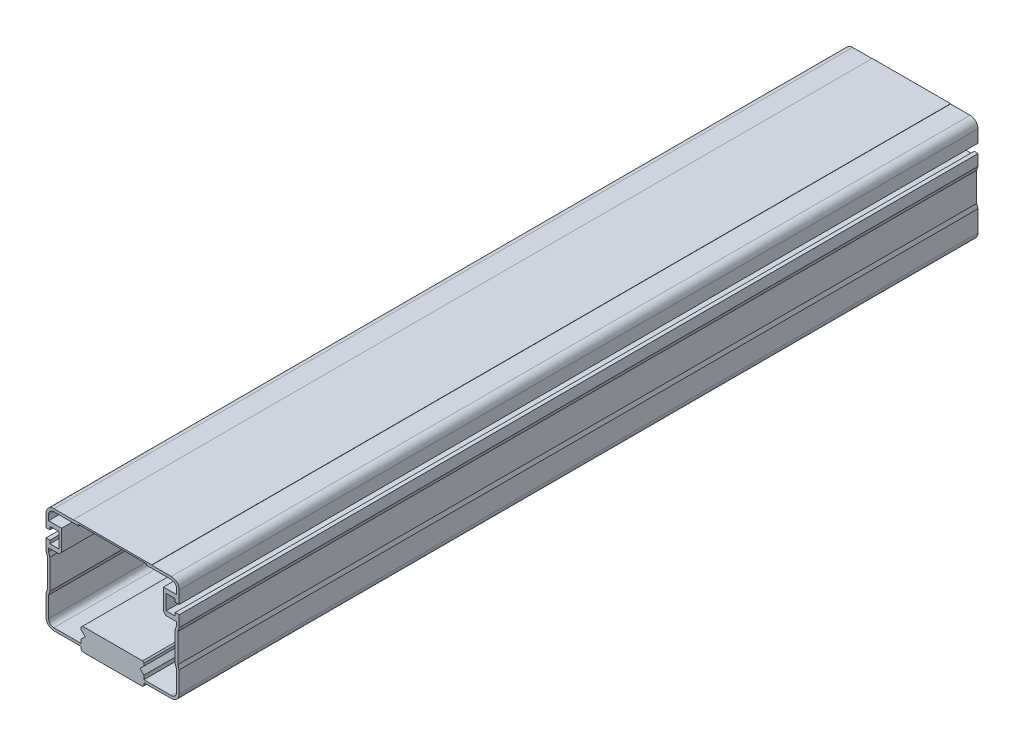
SolidWorks part; units mm, degrees
ref_plane "前视基准面" through (0, 0, 0) normal (0, 0, 1) x (1, 0, 0)
ref_plane "上视基准面" through (0, 0, 0) normal (0, 1, 0) x (1, 0, 0)
ref_plane "右视基准面" through (0, 0, 0) normal (1, 0, 0) x (0, 0, -1)
sketch "草图1" plane through (0, 0, 0) normal (0, 0, 1) x (1, 0, 0)
  line B0 (22.5, 42) -> (15, 42)
  line B1 (15, 42) -> (15, 42.1)
  line B2 (15, 42.1) -> (-15, 42.1)
  line B3 (-15, 42.1) -> (-15, 42)
  line B4 (-15, 42) -> (-22.5, 42)
  line B5 (-25.5, 39) -> (-25.5, 34.2)
  line B6 (-25.5, 34.2) -> (-24, 34.2)
  line B7 (-24, 34.2) -> (-24, 35.4)
  line B8 (-24, 35.4) -> (-20.5, 35.4)
  line B9 (-20.5, 35.4) -> (-20.5, 29.6)
  line B10 (-20.5, 29.6) -> (-24, 29.6)
  line B11 (-24, 29.6) -> (-24, 30.8)
  line B12 (-24, 30.8) -> (-25.5, 30.8)
  line B13 (-25.5, 30.8) -> (-25.5, 26.5)
  line B14 (-25.5, 26.5) -> (-25, 25)
  line B15 (-25, 25) -> (-25, 14)
  line B16 (-25, 14) -> (-25.5, 12.5)
  line B17 (-25.5, 12.5) -> (-25.5, 4.5)
  line B18 (-22.5, 1.5) -> (-12, 1.5)
  line B19 (-12, 1.5) -> (-12, 0.5)
  line B20 (-12, 0.5) -> (-11.5, 0)
  line B21 (-11.5, 0) -> (11.5, 0)
  line B22 (11.5, 0) -> (12, 0.5)
  line B23 (12, 0.5) -> (12, 1.5)
  line B24 (12, 1.5) -> (22.5, 1.5)
  line B25 (25.5, 4.5) -> (25.5, 12.5)
  line B26 (25.5, 12.5) -> (25, 14)
  line B27 (25, 14) -> (25, 25)
  line B28 (25, 25) -> (25.5, 26.5)
  line B29 (25.5, 26.5) -> (25.5, 30.8)
  line B30 (25.5, 30.8) -> (24, 30.8)
  line B31 (24, 30.8) -> (24, 29.6)
  line B32 (24, 29.6) -> (20.5, 29.6)
  line B33 (20.5, 29.6) -> (20.5, 35.4)
  line B34 (20.5, 35.4) -> (24, 35.4)
  line B35 (24, 35.4) -> (24, 34.2)
  line B36 (24, 34.2) -> (25.5, 34.2)
  line B37 (25.5, 34.2) -> (25.5, 39)
  line B38 (12, 2.5) -> (22.5, 2.5)
  line B39 (12, 4) -> (12, 2.5)
  line B40 (10.5, 5.5) -> (12, 4)
  line B41 (12, 7) -> (10.5, 5.5)
  line B42 (12, 8) -> (12, 7)
  line B43 (11.5, 8.5) -> (12, 8)
  line B44 (-11.5, 8.5) -> (11.5, 8.5)
  line B45 (-12, 8) -> (-11.5, 8.5)
  line B46 (-12, 7) -> (-12, 8)
  line B47 (-10.5, 5.5) -> (-12, 7)
  line B48 (-12, 4) -> (-10.5, 5.5)
  line B49 (-12, 2.5) -> (-12, 4)
  line B50 (-22.5, 2.5) -> (-12, 2.5)
  line B51 (-24.5, 12.3377) -> (-24.5, 4.5)
  line B52 (-24, 13.8377) -> (-24.5, 12.3377)
  line B53 (-24, 25.1623) -> (-24, 13.8377)
  line B54 (-24.5, 26.6623) -> (-24, 25.1623)
  line B55 (-24.5, 28) -> (-24.5, 26.6623)
  line B56 (-20.5, 28) -> (-24.5, 28)
  line B57 (-19.5, 29) -> (-20.5, 28)
  line B58 (-19.5, 37) -> (-19.5, 29)
  line B59 (-24.5, 37) -> (-19.5, 37)
  line B60 (-24.5, 39) -> (-24.5, 37)
  line B61 (-13, 41) -> (-22.5, 41)
  line B62 (-13, 41.5) -> (-13, 41)
  line B63 (13, 41.5) -> (-13, 41.5)
  line B64 (13, 41) -> (13, 41.5)
  line B65 (22.5, 41) -> (13, 41)
  line B66 (24.5, 37) -> (24.5, 39)
  line B67 (19.5, 37) -> (24.5, 37)
  line B68 (19.5, 29) -> (19.5, 37)
  line B69 (20.5, 28) -> (19.5, 29)
  line B70 (24.5, 28) -> (20.5, 28)
  line B71 (24.5, 26.6623) -> (24.5, 28)
  line B72 (24, 25.1623) -> (24.5, 26.6623)
  line B73 (24, 13.8377) -> (24, 25.1623)
  line B74 (24.5, 12.3377) -> (24, 13.8377)
  line B75 (24.5, 4.5) -> (24.5, 12.3377)
  arc B76 (-22.5, 42) -> (-25.5, 39) centre (-22.5, 39) ccw
  arc B77 (-25.5, 4.5) -> (-22.5, 1.5) centre (-22.5, 4.5) ccw
  arc B78 (22.5, 1.5) -> (25.5, 4.5) centre (22.5, 4.5) ccw
  arc B79 (25.5, 39) -> (22.5, 42) centre (22.5, 39) ccw
  arc B80 (-24.5, 4.5) -> (-22.5, 2.5) centre (-22.5, 4.5) ccw
  arc B81 (-22.5, 41) -> (-24.5, 39) centre (-22.5, 39) ccw
  arc B82 (24.5, 39) -> (22.5, 41) centre (22.5, 39) ccw
  arc B83 (22.5, 2.5) -> (24.5, 4.5) centre (22.5, 4.5) ccw
sketch_block_instance "块3-1"
sketch_block "块3"
extrude "凸台-拉伸1" add sketch "草图1" along normal blind 306
hole_wizard "M5 螺纹孔2" positions "草图4" profile "草图5" tap size "M5" standard "GB"
sketch "草图4" plane through (0, 0, 0) normal (0, -1, 0) x (-1, 0, 0)
  line L0 (0, -518) -> (0, -1380.0153) construction
  line L3 (11.5, -306) -> (-11.5, -306) construction
  point P2 (0, -263)
  point P12 (0, -223)
  point P14 (0, -183)
  point P16 (0, -143)
  point P18 (0, -103)
  point P20 (0, -63)
  point P22 (0, -23)
  point P24 (0, 17)
  point P42 (0, 57)
  point P44 (0, 97)
  point P46 (0, 137)
  point P48 (0, 177)
  point P50 (0, 217)
  point P52 (0, 257)
  point P53 (0, 297)
  point P55 (0, 337)
  point P57 (0, 377)
  point P59 (0, 417)
  point P61 (0, 457)
  point P63 (0, 497)
  point P65 (0, 537)
  point P68 (0, 617)
  point P71 (0, 577)
  dimension "D1" = 43
  dimension "D2" = 40
  dimension "D3" = 40
  dimension "D4" = 40
  dimension "D5" = 40
  dimension "D6" = 40
  dimension "D7" = 40
  dimension "D8" = 40
  dimension "D9" = 40
  dimension "D10" = 40
  dimension "D11" = 40
  dimension "D12" = 40
  dimension "D13" = 40
  dimension "D14" = 40
  dimension "D15" = 40
  dimension "D16" = 40
  dimension "D17" = 40
  dimension "D18" = 40
  dimension "D19" = 40
  dimension "D20" = 40
  dimension "D21" = 40
  dimension "D22" = 40
  dimension "D23" = 40
sketch "草图5" plane through (0, 0, 263) normal (1, 0, 0) x (0, 0, -1)
  line L0 (0, 0) -> (0, 15.6618)
  line L1 (0, 15.6618) -> (2.1, 14.4)
  line L2 (2.1, 14.4) -> (2.1, 0)
  line L5 (2.1, 0) -> (0, 0)
  line L10 (0, 15.6618) -> (-2.1, 14.4) construction
  line L11 (0, -6.35) -> (0, 107.95) construction
  dimension "螺纹孔钻头直径" = 4.2
  dimension "螺纹孔钻头深度" = 14.4
  dimension "导头角度" = 118
